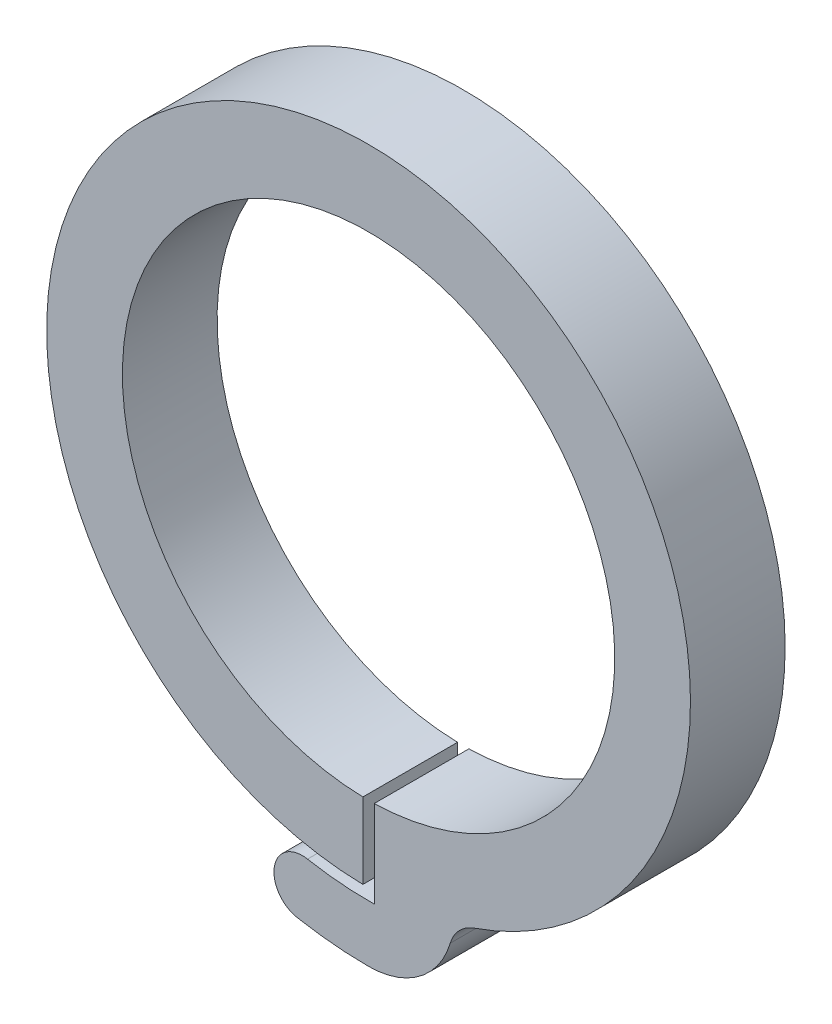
SolidWorks part; units mm, degrees
ref_plane "Front Plane" through (0, 0, 0) normal (0, 0, 1) x (1, 0, 0)
ref_plane "Top Plane" through (0, 0, 0) normal (0, 1, 0) x (1, 0, 0)
ref_plane "Right Plane" through (0, 0, 0) normal (1, 0, 0) x (0, 0, -1)
sketch "Esquisse1" plane through (0, 0, 0) normal (0, 0, 1) x (1, 0, 0)
  line L0 (-12.171, -4.5681) -> (-12.4214, -4.9028) construction
  line L2 (0, 0) -> (0, -28.6289) construction
  line L3 (-0.3, -12.9965) -> (-0.3, -16.9974)
  line L9 (-0.3, -12.9965) -> (0.3, -12.9965) construction
  line L11 (0.3, -12.9965) -> (0.3, -17.5965)
  line L13 (4.1371, -25.0077) -> (-5.5366, -25.0077) construction
  line L18 (-16.399, -4.4802) -> (-16.399, -4.4802) construction
  line L19 (0.172, -14.6059) -> (-0.8485, -21.0077) construction
  line L20 (-3.8458, -14.4008) -> (-5.5366, -25.0077) construction
  line L21 (-0.806, -21.0077) -> (-0.8485, -21.0077) construction
  line L22 (-0.806, -21.0077) -> (-2.5686, -12.7437) construction
  line L23 (4.1371, -25.0077) -> (2.3931, -16.8307) construction
  arc A0 (-0.3, -16.9974) -> (5.5745, -16.06) centre (0, 0) cw
  arc A1 (-0.3, -12.9965) -> (0.3, -12.9965) centre (0, 0) cw
  arc A2 (4.3133, -17.3793) -> (0, -20.5965) centre (0, -16.0965) cw
  arc A3 (0, -20.5965) -> (-3.7747, -20.2477) centre (0, 0) cw
  arc A4 (0.172, -14.6059) -> (-4.6618, -17.0191) centre (-2.8722, -14.556) ccw construction
  arc A5 (-3.8458, -14.4008) -> (-3.8458, -14.4008) centre (-3.8458, -14.4008) ccw construction
  arc A6 (-3.2253, -17.301) -> (0.3, -17.5965) centre (0, 0) ccw
  arc A7 (-12.171, -4.5681) -> (-2.5686, -12.7437) centre (0, 0) cw construction
  arc A8 (-16.399, -4.4802) -> (2.3931, -16.8307) centre (0, 0) cw construction
  arc A9 (-3.2253, -17.301) -> (-3.7747, -20.2477) centre (-3.5, -18.7744) ccw
  arc A11 (4.3133, -17.3793) -> (5.5745, -16.06) centre (6.2303, -17.9495) cw
  point P5 (4, -18.5742)
  point P8 (1, -25.506)
  point P18 (4, -29.7904)
  dimension "D1" = 13
  dimension "D2" = 4
  dimension "D6" = 3.5
  dimension "D8" = 2
  dimension "D4" = 4.6
  dimension "D7" = 4.5
  dimension "D3" = 0.6
  dimension "D5" = 3
extrude "Boss.-Extru.1" add sketch "Esquisse1" along normal mid plane 5
